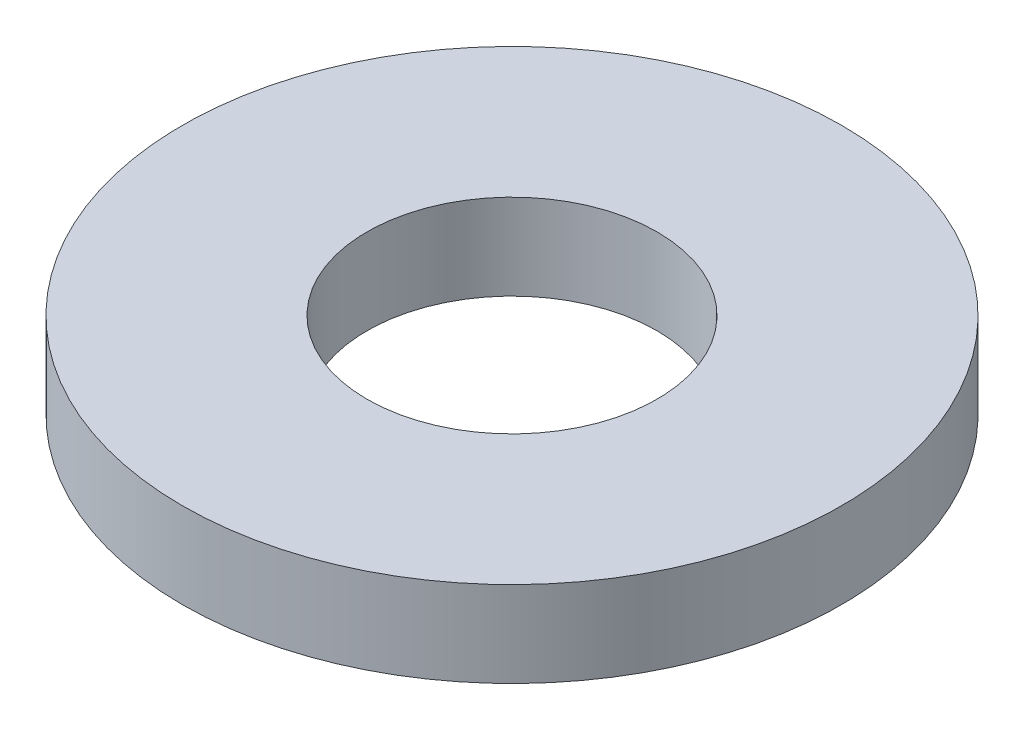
SolidWorks part; units mm, degrees
ref_plane "Front Plane" through (0, 0, 0) normal (0, 0, 1) x (1, 0, 0)
ref_plane "Top Plane" through (0, 0, 0) normal (0, 1, 0) x (1, 0, 0)
ref_plane "Right Plane" through (0, 0, 0) normal (1, 0, 0) x (0, 0, -1)
sketch "Sketch1" plane through (0, 0, 0) normal (0, 1, 0) x (1, 0, 0)
  circle A0 centre (0, 0) radius 6.35
  dimension "OD" = 12.7
extrude "Boss-Extrude1" add sketch "Sketch1" along normal blind 1.651
sketch "Sketch5" plane through (0, 1.651, 0) normal (0, 1, 0) x (-1, 0, 0)
  circle A0 centre (0, 0) radius 2.794
  dimension "ID" = 5.588
extrude "Cut-Extrude1" cut sketch "Sketch5" against normal through all
